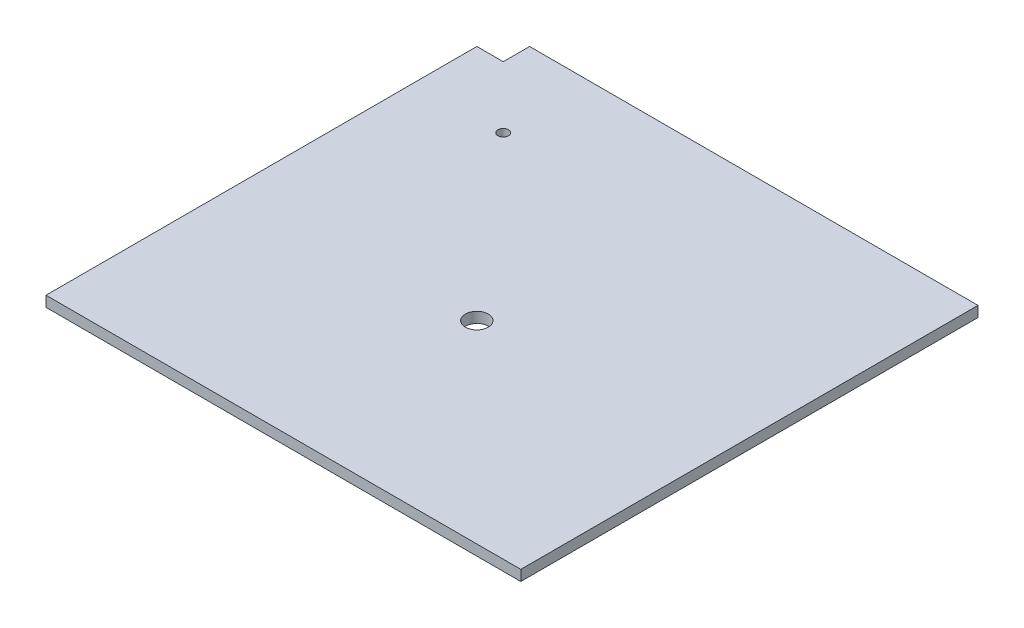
SolidWorks part; units mm, degrees
ref_plane "Front Plane" through (0, 0, 0) normal (0, 0, 1) x (1, 0, 0)
ref_plane "Top Plane" through (0, 0, 0) normal (0, 1, 0) x (1, 0, 0)
ref_plane "Right Plane" through (0, 0, 0) normal (1, 0, 0) x (0, 0, -1)
sketch "Sketch1" plane through (0, 0, 0) normal (0, 1, 0) x (1, 0, 0)
  line L1 (-135, -130) -> (135, -130)
  line L2 (-135, -130) -> (-135, 130)
  line L3 (-135, 130) -> (135, 130)
  line L4 (135, -130) -> (135, 130)
  line L5 (-135, -130) -> (135, 130) construction
  line L6 (-135, 130) -> (135, -130) construction
  point P0 (0, 0)
  dimension "D1" = 270
  dimension "D2" = 260
extrude "Boss-Extrude1" add sketch "Sketch1" along normal blind 6
sketch "Sketch2" plane through (0, 6, 0) normal (0, 1, 0) x (1, 0, 0)
  line L0 (0, 0) -> (0, -20) construction
  line L1 (-135, -130) -> (135, -130) construction
  circle A0 centre (0, -20) radius 6.5
  circle A1 centre (0, -20) radius 105 construction
  point P4 (0, -125)
  dimension "D1" = 13
  dimension "D2" = 210
  dimension "D3" = 5
extrude "Cut-Extrude1" cut sketch "Sketch2" against normal up to next
sketch "Sketch3" plane through (0, 6, 0) normal (0, 1, 0) x (1, 0, 0)
  line L0 (135, 130) -> (-135, 130) construction
  line L1 (-135, 130) -> (-120, 130)
  line L2 (-135, 130) -> (-135, 115)
  line L3 (-135, 115) -> (-120, 115)
  line L4 (-120, 130) -> (-120, 115)
  line L5 (-135, 130) -> (-135, -130) construction
  circle A0 centre (-85, 80) radius 3
  dimension "D3" = 6
  dimension "D4" = 50
  dimension "D1" = 15
  dimension "D2" = 15
  dimension "D5" = 50
extrude "Cut-Extrude2" cut sketch "Sketch3" against normal through all
